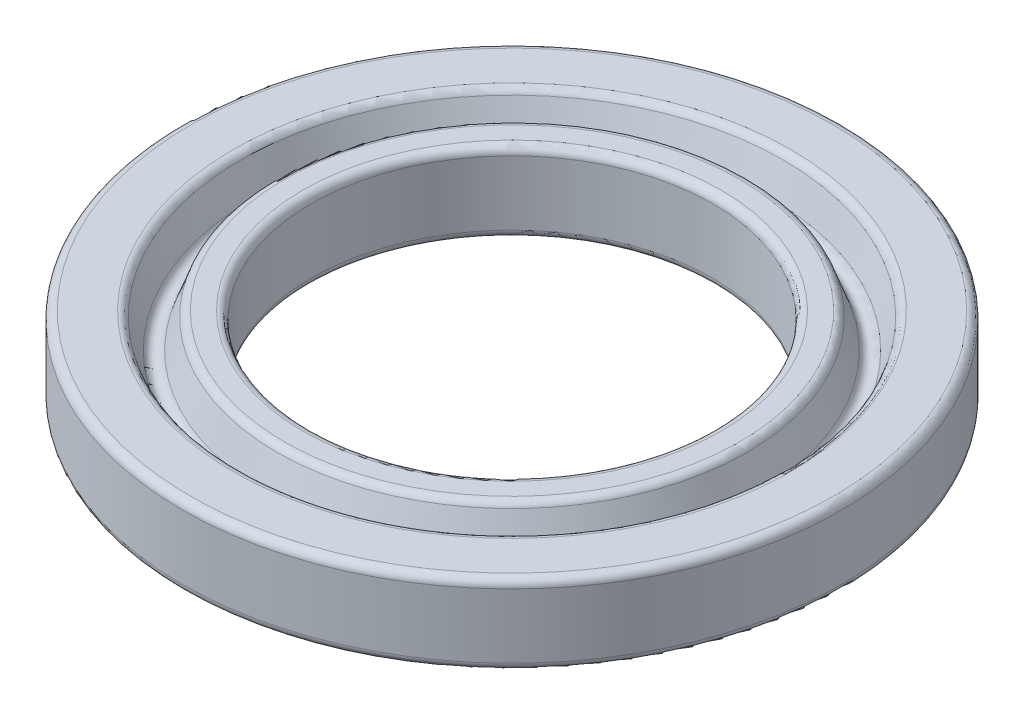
SolidWorks part; units mm, degrees
ref_plane "Plan1" through (0, 0, 0) normal (0, 0, 1) x (1, 0, 0)
ref_plane "Plan2" through (0, 0, 0) normal (0, 1, 0) x (1, 0, 0)
ref_plane "Plan3" through (0, 0, 0) normal (1, 0, 0) x (0, 0, -1)
sketch "Esquisse1" plane through (0, 0, 0) normal (0, 0, 1) x (1, 0, 0)
  line L0 (0, 40) -> (0, -40) construction
  line L1 (7.25, 2.5) -> (7.875, 0.7828)
  line L2 (6.25, 0) -> (8.25, 0)
  line L3 (6.25, 0) -> (6.25, 2.5)
  line L4 (6.25, 2.5) -> (7.25, 2.5)
  line L5 (10.25, 0) -> (10.25, 2.5)
  line L6 (8.5, 2.5) -> (7.875, 0.7828)
  line L7 (8.5, 2.5) -> (10.25, 2.5)
  line L8 (9.25, 0) -> (8.7571, 1.3544)
  line L9 (8.25, 0) -> (8.7571, 1.3544)
  line L10 (9.25, 0) -> (10.25, 0)
  dimension "D1" = 6.25
  dimension "D2" = 10.25
  dimension "D3" = 2.5
  dimension "D4" = 1
  dimension "D5" = 110
  dimension "D6" = 110
  dimension "D7" = 1.75
  dimension "D8" = 1
  dimension "D9" = 110
revolve "Base-Révolution" add sketch "Esquisse1" angle 360 about L0
fillet "Congé1" radius 0.25
